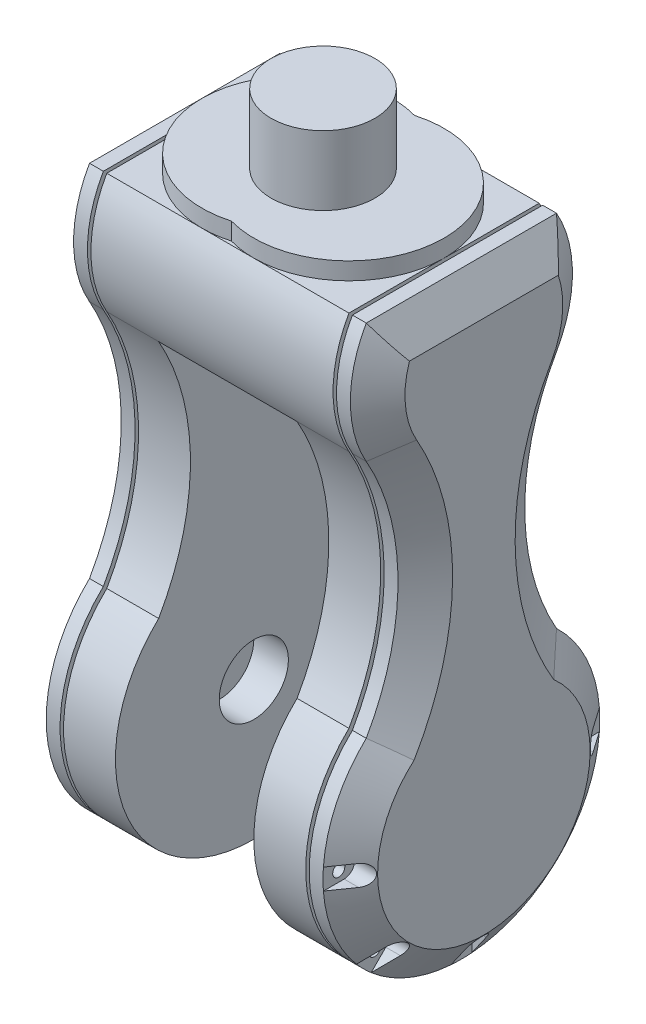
SolidWorks part; units mm, degrees
ref_plane "Front Plane" through (0, 0, 0) normal (0, 0, 1) x (1, 0, 0)
ref_plane "Top Plane" through (0, 0, 0) normal (0, 1, 0) x (1, 0, 0)
ref_plane "Right Plane" through (0, 0, 0) normal (1, 0, 0) x (0, 0, -1)
sketch "Sketch1" plane through (0, 0, 0) normal (0, 1, 0) x (1, 0, 0)
  circle A0 centre (0, 0) radius 27.5
  dimension "D1" = 55
extrude "Boss-Extrude1" add sketch "Sketch1" along normal blind 5
ref_plane "Plane1" through (27.5, 0, 0) normal (1, 0, 0) x (0, 0, -1)
sketch "Sketch5" plane through (27.5, 0, 0) normal (1, 0, 0) x (0, 0, -1)
  line L0 (0, 0) -> (0, -23) construction
  line L1 (-27.5, 0) -> (27.5, 0)
  arc A0 (27.5, 0) -> (27.5, -34.6509) centre (-2.911, -17.3254) cw
  arc A1 (27.5, -34.6509) -> (27.5, -103.9526) centre (88.322, -69.3017) ccw
  arc A2 (-27.5, 0) -> (-27.5, -34.6509) centre (2.911, -17.3254) ccw
  arc A3 (-27.5, -34.6509) -> (-27.5, -103.9526) centre (-88.322, -69.3017) cw
  arc A4 (-27.5, -103.9526) -> (27.5, -103.9526) centre (0, -133) ccw
  dimension "D2" = 70
  dimension "D3" = 80
  dimension "D5" = 35
  dimension "D1" = 23
  dimension "D4" = 110
extrude "Boss-Extrude2" add sketch "Sketch5" along normal blind 15 separate body
sketch "Sketch10" plane through (42.5, 0, 0) normal (1, 0, 0) x (0, 0, -1)
  line L2 (26.0106, -2.5) -> (-26.0106, -2.5)
  line L3 (26.0106, -2.5) -> (-26.0106, -2.5)
  arc A10 (25.3278, -33.4133) -> (26.0106, -2.5) centre (-2.911, -17.3254) ccw
  arc A11 (-26.0106, -2.5) -> (-25.3278, -33.4133) centre (2.911, -17.3254) ccw
  arc A12 (-25.5171, -105.5204) -> (-25.3278, -33.4133) centre (-88.322, -69.3017) ccw
  arc A13 (-25.5171, -105.5204) -> (25.5171, -105.5204) centre (0, -133) ccw
  arc A14 (25.3278, -33.4133) -> (25.5171, -105.5204) centre (88.322, -69.3017) ccw
  arc A15 (25.3278, -33.4133) -> (26.0106, -2.5) centre (-2.911, -17.3254) ccw
  arc A16 (-26.0106, -2.5) -> (-25.3278, -33.4133) centre (2.911, -17.3254) ccw
  arc A17 (-25.5171, -105.5204) -> (-25.3278, -33.4133) centre (-88.322, -69.3017) ccw
  arc A18 (-25.5171, -105.5204) -> (25.5171, -105.5204) centre (0, -133) ccw
  arc A19 (25.3278, -33.4133) -> (25.5171, -105.5204) centre (88.322, -69.3017) ccw
  dimension "D1" = 2.5
extrude "Boss-Extrude4" add sketch "Sketch10" along normal blind 1
sketch "Sketch11" plane through (43.5, 0, 0) normal (1, 0, 0) x (0, 0, -1)
  line L2 (27.5, 0) -> (-27.5, 0)
  line L3 (27.5, 0) -> (-27.5, 0)
  arc A10 (27.5, -34.6509) -> (27.5, 0) centre (-2.911, -17.3254) ccw
  arc A11 (-27.5, 0) -> (-27.5, -34.6509) centre (2.911, -17.3254) ccw
  arc A12 (-27.5, -103.9526) -> (-27.5, -34.6509) centre (-88.322, -69.3017) ccw
  arc A13 (-27.5, -103.9526) -> (27.5, -103.9526) centre (0, -133) ccw
  arc A14 (27.5, -34.6509) -> (27.5, -103.9526) centre (88.322, -69.3017) ccw
  arc A15 (27.5, -34.6509) -> (27.5, 0) centre (-2.911, -17.3254) ccw
  arc A16 (-27.5, 0) -> (-27.5, -34.6509) centre (2.911, -17.3254) ccw
  arc A17 (-27.5, -103.9526) -> (-27.5, -34.6509) centre (-88.322, -69.3017) ccw
  arc A18 (-27.5, -103.9526) -> (27.5, -103.9526) centre (0, -133) ccw
  arc A19 (27.5, -34.6509) -> (27.5, -103.9526) centre (88.322, -69.3017) ccw
  dimension "D1" = 0
extrude "Boss-Extrude6" add sketch "Sketch11" along normal blind 4
sketch "Sketch12" plane through (47.5, 0, 0) normal (1, 0, 0) x (0, 0, -1)
  line L1 (27.5, 0) -> (-27.5, 0)
  line L2 (27.5, 0) -> (-27.5, 0)
  arc A5 (27.5, -34.6509) -> (27.5, -103.9526) centre (88.322, -69.3017) ccw
  arc A6 (27.5, -34.6509) -> (27.5, 0) centre (-2.911, -17.3254) ccw
  arc A7 (-27.5, 0) -> (-27.5, -34.6509) centre (2.911, -17.3254) ccw
  arc A8 (-27.5, -103.9526) -> (-27.5, -34.6509) centre (-88.322, -69.3017) ccw
  arc A9 (-27.5, -103.9526) -> (27.5, -103.9526) centre (0, -133) ccw
  arc A10 (27.5, -34.6509) -> (27.5, -103.9526) centre (88.322, -69.3017) ccw
  arc A11 (27.5, -34.6509) -> (27.5, 0) centre (-2.911, -17.3254) ccw
  arc A12 (-27.5, 0) -> (-27.5, -34.6509) centre (2.911, -17.3254) ccw
  arc A13 (-27.5, -103.9526) -> (-27.5, -34.6509) centre (-88.322, -69.3017) ccw
  arc A14 (-27.5, -103.9526) -> (27.5, -103.9526) centre (0, -133) ccw
  dimension "D1" = 0
extrude "Boss-Extrude7" add sketch "Sketch12" along normal blind 6.5 draft 55
sketch "Sketch13" plane through (54, 0, 0) normal (1, 0, 0) x (0, 0, -1)
  line L0 (0, 0) -> (0, -173) construction
  line L1 (3, -172.8873) -> (3, -166.8873)
  line L2 (-3, -172.8873) -> (-3, -166.8873)
  arc A0 (-27.5, -103.9526) -> (27.5, -103.9526) centre (0, -133) ccw construction
  arc A1 (-3, -166.8873) -> (3, -166.8873) centre (0, -166.8873) cw
  arc A2 (-3, -172.8873) -> (3, -172.8873) centre (0, -168.8873) ccw
  dimension "D3" = 5
  dimension "D1" = 3
  dimension "D2" = 6
extrude "Cut-Extrude1" cut sketch "Sketch13" against normal blind 6.5
sketch "Sketch14" plane through (47.5, 0, 0) normal (1, 0, 0) x (0, 0, -1)
  line L0 (0, -173) -> (0, -163.8873) construction
  arc A0 (-3, -172.8873) -> (3, -172.8873) centre (0, -133) ccw construction
  arc A1 (3, -166.8873) -> (-3, -166.8873) centre (0, -166.8873) ccw construction
  circle A2 centre (0, -168.4437) radius 1.75
  dimension "D1" = 3.5
extrude "Cut-Extrude2" cut sketch "Sketch14" against normal blind 5
pattern_circular "CirPattern2" count 3 every 45 about axis through (0, -133, 0) along (1, 0, 0) of "Cut-Extrude1", "Cut-Extrude2"
sketch "Sketch15" plane through (27.5, 0, 0) normal (-1, 0, 0) x (0, 0, 1)
  line L0 (-27.5, -34.6509) -> (27.5, -34.6509)
  line L1 (27.5, 0) -> (-27.5, 0)
  line L2 (27.5, 0) -> (-27.5, 0)
  arc A5 (-27.5, 0) -> (-27.5, -34.6509) centre (2.911, -17.3254) ccw
  arc A6 (-27.5, -103.9526) -> (-27.5, -34.6509) centre (-88.322, -69.3017) ccw
  arc A7 (-27.5, -103.9526) -> (27.5, -103.9526) centre (0, -133) ccw
  arc A8 (27.5, -34.6509) -> (27.5, -103.9526) centre (88.322, -69.3017) ccw
  arc A9 (27.5, -34.6509) -> (27.5, 0) centre (-2.911, -17.3254) ccw
  arc A10 (-27.5, 0) -> (-27.5, -34.6509) centre (2.911, -17.3254) ccw
  arc A14 (27.5, -34.6509) -> (27.5, 0) centre (-2.911, -17.3254) ccw
  dimension "D1" = 0
extrude "Boss-Extrude8" add sketch "Sketch15" along normal blind 40
ref_plane "Plane2" through (7.5, 0, 0) normal (-1, 0, 0) x (0, 0, 1)
mirror "Mirror1" about plane through (7.5, 0, 0) normal (-1, 0, 0)
sketch "Sketch19" plane through (0, 5, 0) normal (0, 1, 0) x (1, 0, 0)
  line L0 (7.5, 26.4575) -> (7.5, -26.4575) construction
  circle A0 centre (7.5, 0) radius 15
  dimension "D1" = 30
extrude "Boss-Extrude9" add sketch "Sketch19" along normal blind 20
sketch "Sketch21" plane through (-12.5, 0, 0) normal (1, 0, 0) x (0, 0, -1)
  circle A0 centre (0, -133) radius 10
  dimension "D1" = 20
extrude "Cut-Extrude3" cut sketch "Sketch21" against normal blind 10
mirror "Mirror2" about plane through (7.5, 0, 0) normal (-1, 0, 0) of "Cut-Extrude3"
